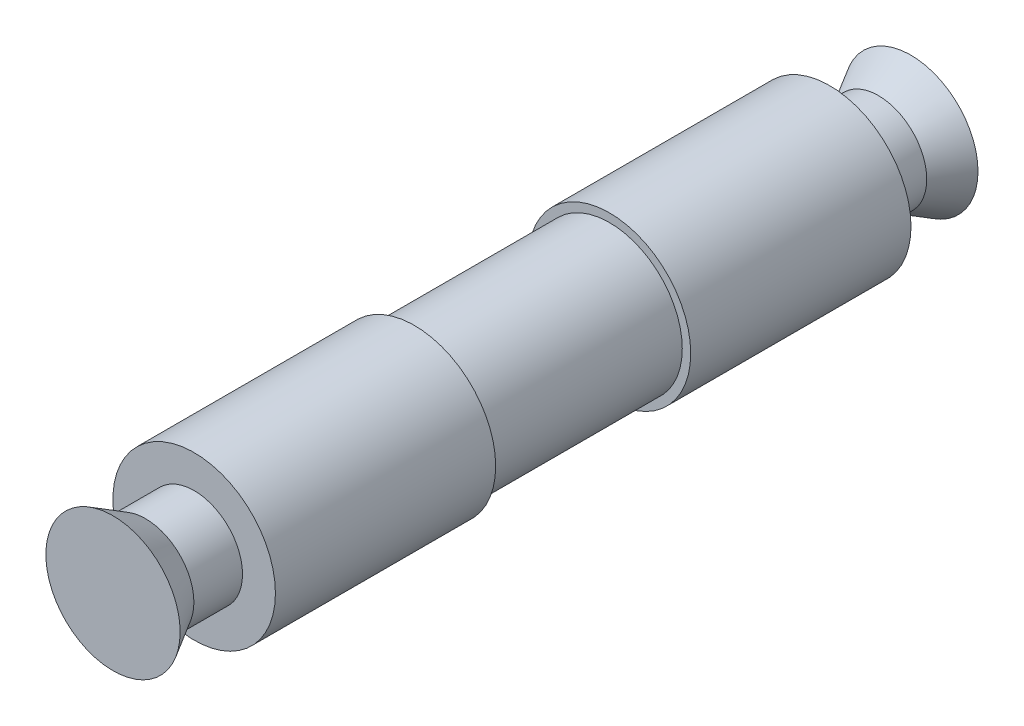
SolidWorks part; units mm, degrees
ref_plane "Спереди" through (0, 0, 0) normal (0, 0, 1) x (1, 0, 0)
ref_plane "Сверху" through (0, 0, 0) normal (0, 1, 0) x (1, 0, 0)
ref_plane "Справа" through (0, 0, 0) normal (1, 0, 0) x (0, 0, -1)
sketch "Эскиз1" plane through (0, 0, 0) normal (1, 0, 0) x (0, 0, -1)
  line L0 (0, 0) -> (61.0102, 0) construction
  line L1 (0, 0) -> (38.9636, 0)
  line L2 (38.9636, 0) -> (38.9636, 3.2787)
  line L3 (38.9636, 3.2787) -> (37.3761, 2.3622)
  line L4 (37.3761, 2.3622) -> (35.0012, 2.3622)
  line L5 (35.0012, 2.3622) -> (35.0012, 3.9688)
  line L6 (35.0012, 3.9688) -> (24.2443, 3.9688)
  line L7 (24.2443, 3.9688) -> (24.2443, 3.556)
  line L8 (24.2443, 3.556) -> (14.7193, 3.556)
  line L9 (14.7193, 3.556) -> (14.7193, 3.9688)
  line L10 (14.7193, 3.9688) -> (3.9624, 3.9687)
  line L11 (3.9624, 3.9687) -> (3.9624, 2.3622)
  line L12 (3.9624, 2.3622) -> (1.5875, 2.3622)
  line L13 (1.5875, 2.3622) -> (0, 3.2787)
  line L14 (0, 3.2787) -> (0, 0)
  line L15 (19.4818, 16.3558) -> (19.4818, -7.939) construction
  dimension "D1" = 30
  dimension "D2" = 1.5875
  dimension "D3" = 30
  dimension "D4" = 1.5875
  dimension "D5" = 38.9636
  dimension "D6" = 3.9624
  dimension "D7" = 3.9624
  dimension "D8" = 9.525
  dimension "D9" = 4.7244
  dimension "D10" = 7.112
  dimension "D11" = 7.9375
revolve "Повернуть1" add sketch "Эскиз1" angle 360 about L0
